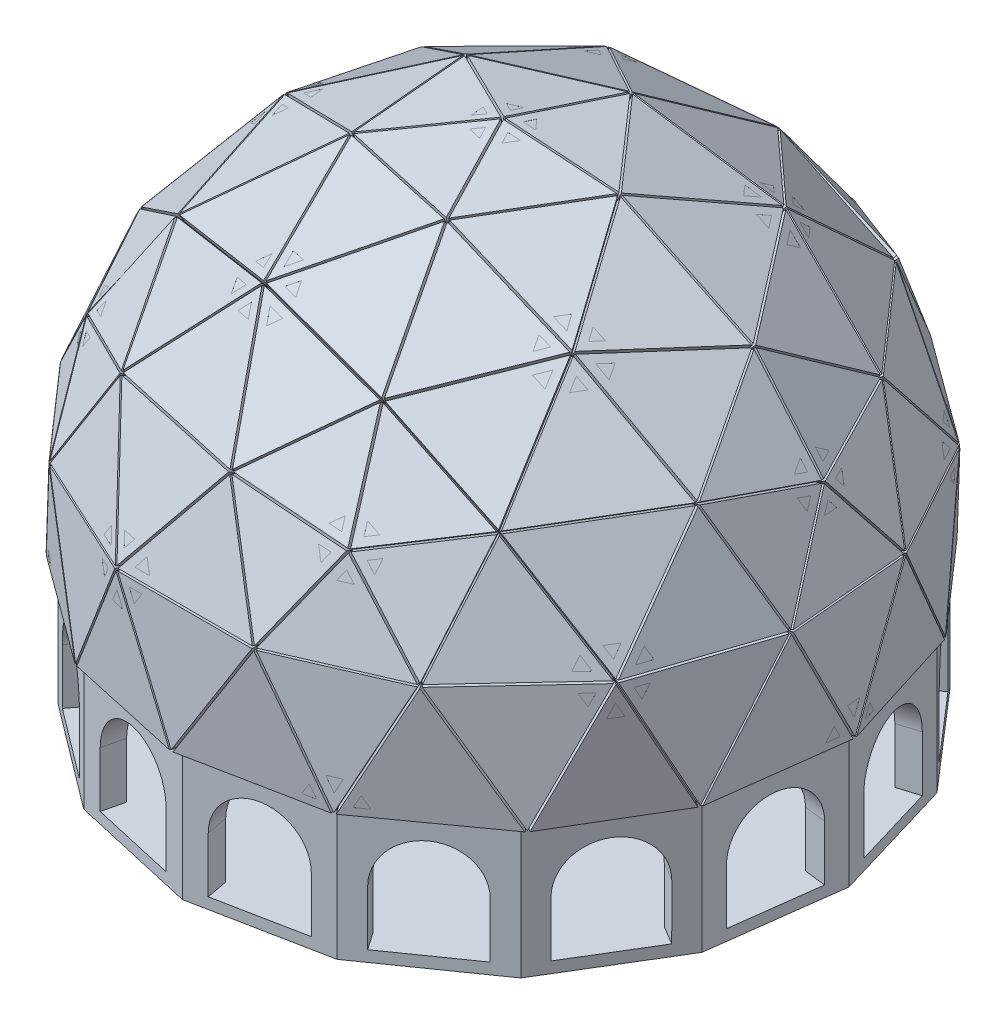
SolidWorks part; units mm, degrees
ref_plane "Front Plane" through (0, 0, 0) normal (0, 0, 1) x (1, 0, 0)
ref_plane "Top Plane" through (0, 0, 0) normal (0, 1, 0) x (1, 0, 0)
ref_plane "Right Plane" through (0, 0, 0) normal (1, 0, 0) x (0, 0, -1)
imported_body "Dome_General_Assy 1-1/Hexagon_Assy-1/Hexagon_Triangle_Large-4-solid1"
imported_body "Dome_General_Assy 1-1/Hexagon_Assy-1/Hexagon_Triangle_Large-5-solid1"
imported_body "Dome_General_Assy 1-1/Hexagon_Assy-1/Hexagon_Triangle_Large-6-solid1"
imported_body "Dome_General_Assy 1-1/Hexagon_Assy-1/Hexagon_Triangle_Small-6-solid1"
imported_body "Dome_General_Assy 1-1/Hexagon_Assy-1/Hexagon_Triangle_Small-7-solid1"
imported_body "Dome_General_Assy 1-1/Hexagon_Assy-1/Hexagon_Triangle_Small-8-solid1"
imported_body "Dome_General_Assy 1-1/Half_Hexagon_Assy-1/Hexagon_Triangle_Large-1-solid1"
imported_body "Dome_General_Assy 1-1/Half_Hexagon_Assy-1/Hexagon_Triangle_Large-2-solid1"
imported_body "Dome_General_Assy 1-1/Half_Hexagon_Assy-1/Hexagon_Triangle_Small-7-solid1"
imported_body "Dome_General_Assy 1-1/Half_Hexagon_Assy-2/Hexagon_Triangle_Large-1-solid1"
imported_body "Dome_General_Assy 1-1/Half_Hexagon_Assy-2/Hexagon_Triangle_Large-2-solid1"
imported_body "Dome_General_Assy 1-1/Half_Hexagon_Assy-2/Hexagon_Triangle_Small-7-solid1"
imported_body "Dome_General_Assy 1-1/Hexagon_Assy-2/Hexagon_Triangle_Large-4-solid1"
imported_body "Dome_General_Assy 1-1/Hexagon_Assy-2/Hexagon_Triangle_Large-5-solid1"
imported_body "Dome_General_Assy 1-1/Hexagon_Assy-2/Hexagon_Triangle_Large-6-solid1"
imported_body "Dome_General_Assy 1-1/Hexagon_Assy-2/Hexagon_Triangle_Small-6-solid1"
imported_body "Dome_General_Assy 1-1/Hexagon_Assy-2/Hexagon_Triangle_Small-7-solid1"
imported_body "Dome_General_Assy 1-1/Hexagon_Assy-2/Hexagon_Triangle_Small-8-solid1"
imported_body "Dome_General_Assy 1-1/Half_Hexagon_Assy-3/Hexagon_Triangle_Large-1-solid1"
imported_body "Dome_General_Assy 1-1/Half_Hexagon_Assy-3/Hexagon_Triangle_Large-2-solid1"
imported_body "Dome_General_Assy 1-1/Half_Hexagon_Assy-3/Hexagon_Triangle_Small-7-solid1"
imported_body "Dome_General_Assy 1-1/Hexagon_Assy-3/Hexagon_Triangle_Large-4-solid1"
imported_body "Dome_General_Assy 1-1/Hexagon_Assy-3/Hexagon_Triangle_Large-5-solid1"
imported_body "Dome_General_Assy 1-1/Hexagon_Assy-3/Hexagon_Triangle_Large-6-solid1"
imported_body "Dome_General_Assy 1-1/Hexagon_Assy-3/Hexagon_Triangle_Small-6-solid1"
imported_body "Dome_General_Assy 1-1/Hexagon_Assy-3/Hexagon_Triangle_Small-7-solid1"
imported_body "Dome_General_Assy 1-1/Hexagon_Assy-3/Hexagon_Triangle_Small-8-solid1"
imported_body "Dome_General_Assy 1-1/Hexagon_Assy-4/Hexagon_Triangle_Large-4-solid1"
imported_body "Dome_General_Assy 1-1/Hexagon_Assy-4/Hexagon_Triangle_Large-5-solid1"
imported_body "Dome_General_Assy 1-1/Hexagon_Assy-4/Hexagon_Triangle_Large-6-solid1"
imported_body "Dome_General_Assy 1-1/Hexagon_Assy-4/Hexagon_Triangle_Small-6-solid1"
imported_body "Dome_General_Assy 1-1/Hexagon_Assy-4/Hexagon_Triangle_Small-7-solid1"
imported_body "Dome_General_Assy 1-1/Hexagon_Assy-4/Hexagon_Triangle_Small-8-solid1"
imported_body "Dome_General_Assy 1-1/Half_Hexagon_Assy-4/Hexagon_Triangle_Large-1-solid1"
imported_body "Dome_General_Assy 1-1/Half_Hexagon_Assy-4/Hexagon_Triangle_Large-2-solid1"
imported_body "Dome_General_Assy 1-1/Half_Hexagon_Assy-4/Hexagon_Triangle_Small-7-solid1"
imported_body "Dome_General_Assy 1-1/Hexagon_Assy-5/Hexagon_Triangle_Large-4-solid1"
imported_body "Dome_General_Assy 1-1/Hexagon_Assy-5/Hexagon_Triangle_Large-5-solid1"
imported_body "Dome_General_Assy 1-1/Hexagon_Assy-5/Hexagon_Triangle_Large-6-solid1"
imported_body "Dome_General_Assy 1-1/Hexagon_Assy-5/Hexagon_Triangle_Small-6-solid1"
imported_body "Dome_General_Assy 1-1/Hexagon_Assy-5/Hexagon_Triangle_Small-7-solid1"
imported_body "Dome_General_Assy 1-1/Hexagon_Assy-5/Hexagon_Triangle_Small-8-solid1"
imported_body "Dome_General_Assy 1-1/Half_Hexagon_Assy-5/Hexagon_Triangle_Large-1-solid1"
imported_body "Dome_General_Assy 1-1/Half_Hexagon_Assy-5/Hexagon_Triangle_Large-2-solid1"
imported_body "Dome_General_Assy 1-1/Half_Hexagon_Assy-5/Hexagon_Triangle_Small-7-solid1"
imported_body "Dome_General_Assy 1-1/Hexagon_Assy-6/Hexagon_Triangle_Large-4-solid1"
imported_body "Dome_General_Assy 1-1/Hexagon_Assy-6/Hexagon_Triangle_Large-5-solid1"
imported_body "Dome_General_Assy 1-1/Hexagon_Assy-6/Hexagon_Triangle_Large-6-solid1"
imported_body "Dome_General_Assy 1-1/Hexagon_Assy-6/Hexagon_Triangle_Small-6-solid1"
imported_body "Dome_General_Assy 1-1/Hexagon_Assy-6/Hexagon_Triangle_Small-7-solid1"
imported_body "Dome_General_Assy 1-1/Hexagon_Assy-6/Hexagon_Triangle_Small-8-solid1"
imported_body "Dome_General_Assy 1-1/Hexagon_Assy-7/Hexagon_Triangle_Large-4-solid1"
imported_body "Dome_General_Assy 1-1/Hexagon_Assy-7/Hexagon_Triangle_Large-5-solid1"
imported_body "Dome_General_Assy 1-1/Hexagon_Assy-7/Hexagon_Triangle_Large-6-solid1"
imported_body "Dome_General_Assy 1-1/Hexagon_Assy-7/Hexagon_Triangle_Small-6-solid1"
imported_body "Dome_General_Assy 1-1/Hexagon_Assy-7/Hexagon_Triangle_Small-7-solid1"
imported_body "Dome_General_Assy 1-1/Hexagon_Assy-7/Hexagon_Triangle_Small-8-solid1"
imported_body "Dome_General_Assy 1-1/Hexagon_Assy-8/Hexagon_Triangle_Large-4-solid1"
imported_body "Dome_General_Assy 1-1/Hexagon_Assy-8/Hexagon_Triangle_Large-5-solid1"
imported_body "Dome_General_Assy 1-1/Hexagon_Assy-8/Hexagon_Triangle_Large-6-solid1"
imported_body "Dome_General_Assy 1-1/Hexagon_Assy-8/Hexagon_Triangle_Small-6-solid1"
imported_body "Dome_General_Assy 1-1/Hexagon_Assy-8/Hexagon_Triangle_Small-7-solid1"
imported_body "Dome_General_Assy 1-1/Hexagon_Assy-8/Hexagon_Triangle_Small-8-solid1"
imported_body "Dome_General_Assy 1-1/Hexagon_Assy-9/Hexagon_Triangle_Large-4-solid1"
imported_body "Dome_General_Assy 1-1/Hexagon_Assy-9/Hexagon_Triangle_Large-5-solid1"
imported_body "Dome_General_Assy 1-1/Hexagon_Assy-9/Hexagon_Triangle_Large-6-solid1"
imported_body "Dome_General_Assy 1-1/Hexagon_Assy-9/Hexagon_Triangle_Small-6-solid1"
imported_body "Dome_General_Assy 1-1/Hexagon_Assy-9/Hexagon_Triangle_Small-7-solid1"
imported_body "Dome_General_Assy 1-1/Hexagon_Assy-9/Hexagon_Triangle_Small-8-solid1"
imported_body "Dome_General_Assy 1-1/Hexagon_Assy-10/Hexagon_Triangle_Large-4-solid1"
imported_body "Dome_General_Assy 1-1/Hexagon_Assy-10/Hexagon_Triangle_Large-5-solid1"
imported_body "Dome_General_Assy 1-1/Hexagon_Assy-10/Hexagon_Triangle_Large-6-solid1"
imported_body "Dome_General_Assy 1-1/Hexagon_Assy-10/Hexagon_Triangle_Small-6-solid1"
imported_body "Dome_General_Assy 1-1/Hexagon_Assy-10/Hexagon_Triangle_Small-7-solid1"
imported_body "Dome_General_Assy 1-1/Hexagon_Assy-10/Hexagon_Triangle_Small-8-solid1"
imported_body "Dome_General_Assy 1-1/Pentagon_Triangle-1-solid1"
imported_body "Dome_General_Assy 1-1/Pentagon_Triangle-2-solid1"
imported_body "Dome_General_Assy 1-1/Pentagon_Triangle-3-solid1"
imported_body "Dome_General_Assy 1-1/Pentagon_Triangle-4-solid1"
imported_body "Dome_General_Assy 1-1/Pentagon_Triangle-5-solid1"
imported_body "Dome_General_Assy 1-1/Pentagon_Triangle-6-solid1"
imported_body "Dome_General_Assy 1-1/Pentagon_Triangle-7-solid1"
imported_body "Dome_General_Assy 1-1/Pentagon_Triangle-8-solid1"
imported_body "Dome_General_Assy 1-1/Pentagon_Triangle-9-solid1"
imported_body "Dome_General_Assy 1-1/Pentagon_Triangle-10-solid1"
imported_body "Dome_General_Assy 1-1/Pentagon_Triangle-11-solid1"
imported_body "Dome_General_Assy 1-1/Pentagon_Triangle-12-solid1"
imported_body "Dome_General_Assy 1-1/Pentagon_Triangle-13-solid1"
imported_body "Dome_General_Assy 1-1/Pentagon_Triangle-14-solid1"
imported_body "Dome_General_Assy 1-1/Pentagon_Triangle-15-solid1"
imported_body "Dome_General_Assy 1-1/Pentagon_Triangle-16-solid1"
imported_body "Dome_General_Assy 1-1/Pentagon_Triangle-17-solid1"
imported_body "Dome_General_Assy 1-1/Pentagon_Triangle-18-solid1"
imported_body "Dome_General_Assy 1-1/Pentagon_Triangle-19-solid1"
imported_body "Dome_General_Assy 1-1/Pentagon_Triangle-20-solid1"
imported_body "Dome_General_Assy 1-1/Pentagon_Triangle-21-solid1"
imported_body "Dome_General_Assy 1-1/Pentagon_Triangle-22-solid1"
imported_body "Dome_General_Assy 1-1/Pentagon_Triangle-23-solid1"
imported_body "Dome_General_Assy 1-1/Pentagon_Triangle-24-solid1"
imported_body "Dome_General_Assy 1-1/Pentagon_Triangle-25-solid1"
imported_body "Dome_General_Assy 1-1/Pentagon_Triangle-26-solid1"
imported_body "Dome_General_Assy 1-1/Pentagon_Triangle-27-solid1"
imported_body "Dome_General_Assy 1-1/Pentagon_Triangle-28-solid1"
imported_body "Dome_General_Assy 1-1/Pentagon_Triangle-29-solid1"
imported_body "Dome_General_Assy 1-1/Pentagon_Triangle-30-solid1"
imported_body "Doll House Level One 15 sides-1-solid1"
scale "Scale1" bodies to scale 115 143 149 196 139 120 103 124 205 135 192 126 171 155 107 159 163 201 128 188 104 164 174 176 144 150 197 178 121 146 140 136 131 206 193 127 172 156 108 160 scale about origin uniform scaling yes scale factor 0.03125
